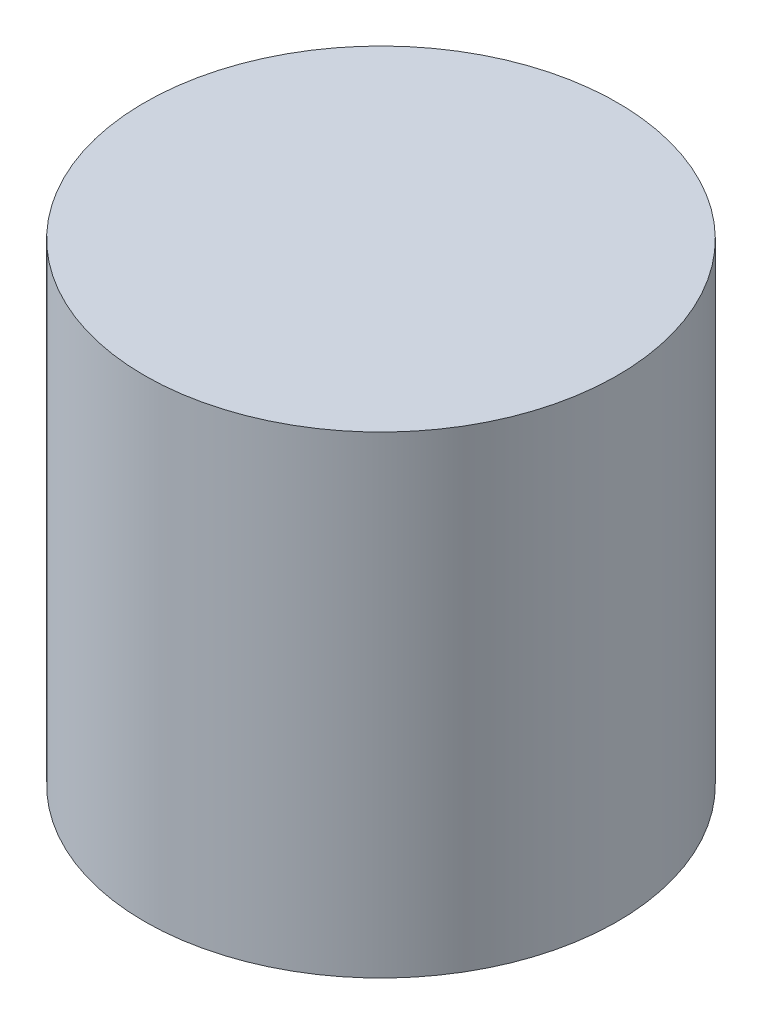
SolidWorks part; units mm, degrees
ref_plane "Vorderansicht" through (0, 0, 0) normal (0, 0, 1) x (1, 0, 0)
ref_plane "Draufsicht" through (0, 0, 0) normal (0, 1, 0) x (1, 0, 0)
ref_plane "Seitenansicht" through (0, 0, 0) normal (1, 0, 0) x (0, 0, -1)
sketch "Skizze1" plane through (0, 0, 0) normal (0, 1, 0) x (1, 0, 0)
  circle A0 centre (0, 0) radius 5
  dimension "D1" = 10
extrude "Linear austragen1" add sketch "Skizze1" along normal blind 10
sketch "Skizze2" plane through (0, 10, 0) normal (0, 1, 0) x (-1, 0, 0)
  point P0 (0, 0)
